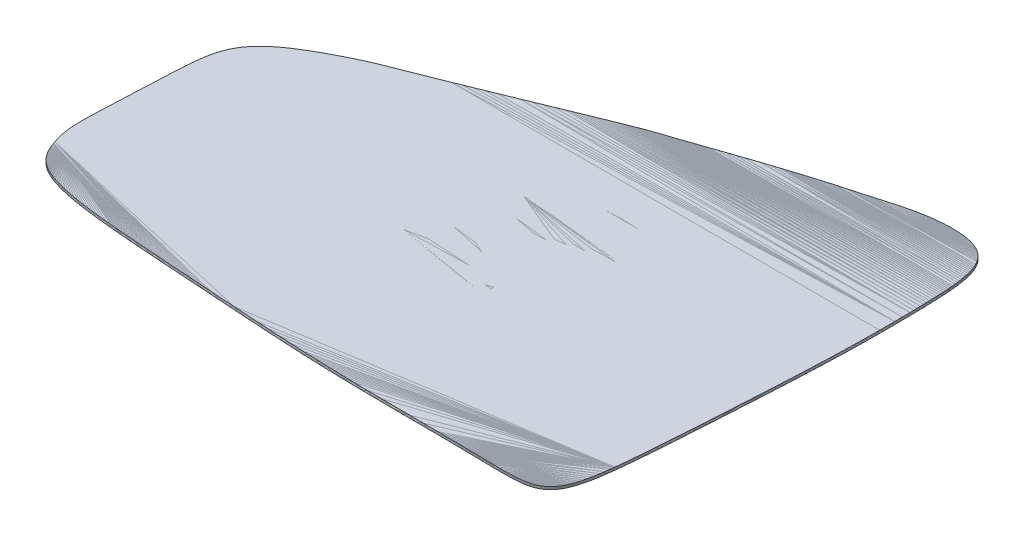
SolidWorks part; units mm, degrees
ref_plane "Спереди" through (0, 0, 0) normal (0, 0, 1) x (1, 0, 0)
ref_plane "Сверху" through (0, 0, 0) normal (0, 1, 0) x (1, 0, 0)
ref_plane "Справа" through (0, 0, 0) normal (1, 0, 0) x (0, 0, -1)
imported_body "Импортированный1"
sketch "Эскиз1" plane through (0, -0.6, 0) normal (0, 1, 0) x (1, 0, 0)
  line L0 (-22.1666, -40.9877) -> (29.2575, -39.6406)
  line L1 (29.2575, -39.6406) -> (27.7153, 19.2286)
  line L2 (-31.5563, 19.2912) -> (64.3032, 19.19) construction
  line L3 (27.7153, 19.2286) -> (-22.1666, 17.6277)
  line L4 (-36.359, 17.3713) -> (64.3032, 19.19) construction
  line L5 (-22.1666, 17.6277) -> (-22.1666, -40.9877)
extrude "Бобышка-Вытянуть1" add sketch "Эскиз1" against normal up to surface (0.6 mm away)
